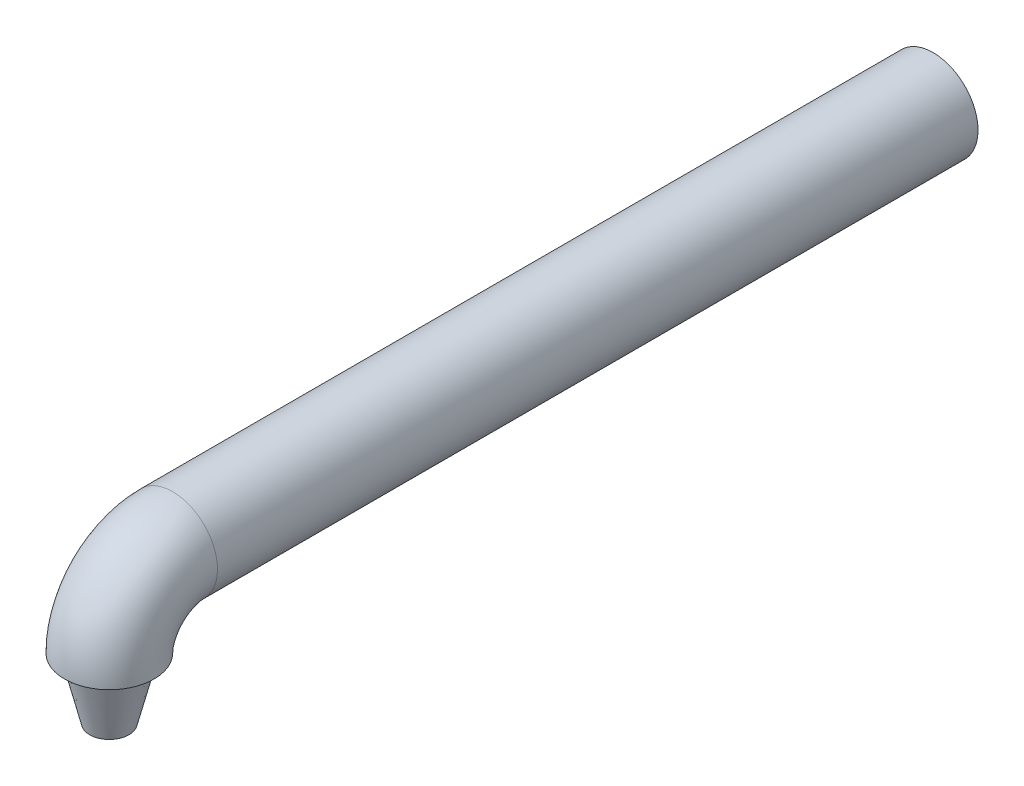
SolidWorks part; units mm, degrees
ref_plane "Front Plane" through (0, 0, 0) normal (0, 0, 1) x (1, 0, 0)
ref_plane "Top Plane" through (0, 0, 0) normal (0, 1, 0) x (1, 0, 0)
ref_plane "Right Plane" through (0, 0, 0) normal (1, 0, 0) x (0, 0, -1)
sketch "Sketch1" plane through (0, 0, 0) normal (1, 0, 0) x (0, 0, -1)
  line L0 (6.35, 6.35) -> (82.55, 6.35)
  line L2 (6.35, 0) -> (6.35, 6.35) construction
  line L3 (6.35, 0) -> (0, 0) construction
  arc A0 (6.35, 6.35) -> (0, 0) centre (6.35, 0) ccw
  dimension "D2" = 76.2
  dimension "D1" = 12.7
sketch "Sketch2" plane through (0, 0, 0) normal (0, 1, 0) x (1, 0, 0)
  circle A0 centre (0, 0) radius 4.4907
  dimension "D1" = 8.9814
sweep "Sweep2" add profiles "Sketch2" path "Sketch1"
sketch "Sketch3" plane through (0, 0, 0) normal (0, -1, 0) x (1, 0, 0)
  circle A0 centre (0, 0) radius 3.4925
  dimension "D1" = 6.985
extrude "Boss-Extrude1" add sketch "Sketch3" along normal blind 6.096 draft 14
